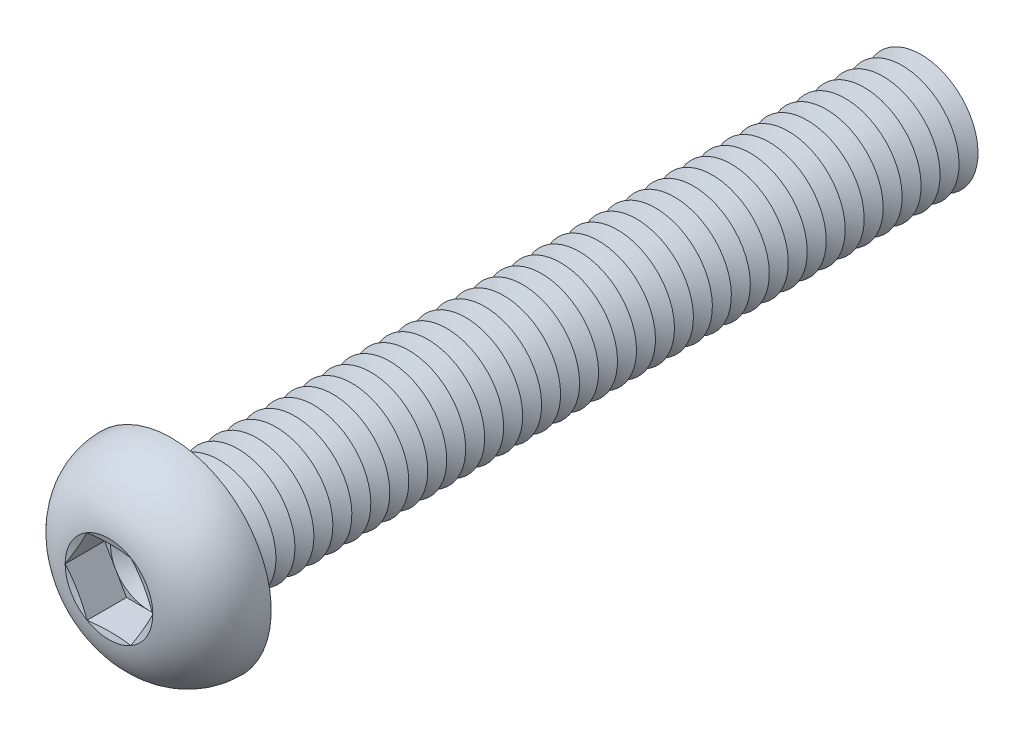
SolidWorks part; units mm, degrees
ref_plane "Front Plane" through (0, 0, 0) normal (0, 0, 1) x (1, 0, 0)
ref_plane "Top Plane" through (0, 0, 0) normal (0, 1, 0) x (1, 0, 0)
ref_plane "Right Plane" through (0, 0, 0) normal (1, 0, 0) x (0, 0, -1)
sketch "Sketch1" plane through (0, 0, 0) normal (1, 0, 0) x (0, 0, -1)
  line L0 (0, 3) -> (0, 5.25)
  line L3 (0, 3) -> (40, 3)
  line L4 (40, 3) -> (40, 0)
  line L5 (40, 0) -> (-3.3, 0) construction
  line L6 (-3.3, 0) -> (40, 0)
  line L7 (-3.3, 2.3094) -> (-3.3, 1.1547) construction
  line L8 (-3.3, 1.1547) -> (-3.3, 0)
  line L9 (-3.3, 2.3094) -> (-2.9906, 1.1547)
  line L10 (-2.9906, 1.1547) -> (-3.3, 1.1547)
  line L11 (40, 0) -> (22.7481, 0) construction
  line L12 (0, 5.25) -> (-3.3, 5.25) construction
  arc A1 (0, 5.25) -> (-3.3, 2.3094) centre (0, 1.928) ccw
  point P8 (40, 1.5)
  dimension "D1" = 10.5
  dimension "D2" = 6
  dimension "D3" = 3.3
  dimension "D4" = 4.6188
  dimension "D5" = 40
  dimension "D6" = 15
revolve "Revolve1" add sketch "Sketch1" angle 360 about L5
fillet "Fillet1" radius 0.5 1 edges at (0, 3, 0)
sketch "Sketch2" plane through (0, 0, 0) normal (1, 0, 0) x (0, 0, -1)
  line L0 (39.5, 3) -> (40.5, 3)
  line L1 (40, 3) -> (0.5, 3) construction
  line L2 (40.5, 3) -> (40, 2.134)
  line L3 (40, -3) -> (40, 3) construction
  line L4 (40, 2.134) -> (39.5, 3)
  dimension "D1" = 1
revolve "Cut-Revolve1" cut sketch "Sketch2" angle 360 about axis through (0, 0, -40) along (0, 0, -1)
pattern_linear "LPattern1" count 40 spacing 1 along (0, 0, 1) of "Cut-Revolve1"
sketch "Sketch3" plane through (0, 0, 3.3) normal (0, 0, 1) x (1, 0, 0)
  line L7 (1.1547, 2) -> (-1.1547, 2)
  line L8 (-1.1547, 2) -> (-2.3094, 0)
  line L9 (-2.3094, 0) -> (-1.1547, -2)
  line L10 (-1.1547, -2) -> (1.1547, -2)
  line L11 (1.1547, -2) -> (2.3094, 0)
  line L12 (2.3094, 0) -> (1.1547, 2)
  circle A0 centre (0, 0) radius 2 construction
  circle A3 centre (0, 0) radius 2.3094 construction
extrude "Cut-Extrude1" cut sketch "Sketch3" against normal blind 2.08
sketch "Sketch4" plane through (0, 0, 1.22) normal (0, 0, 1) x (1, 0, 0)
  line L1 (1.1547, 2) -> (-1.1547, 2) construction
  circle A0 centre (0, 0) radius 2
extrude "Cut-Extrude2" cut sketch "Sketch4" against normal through all draft 60
